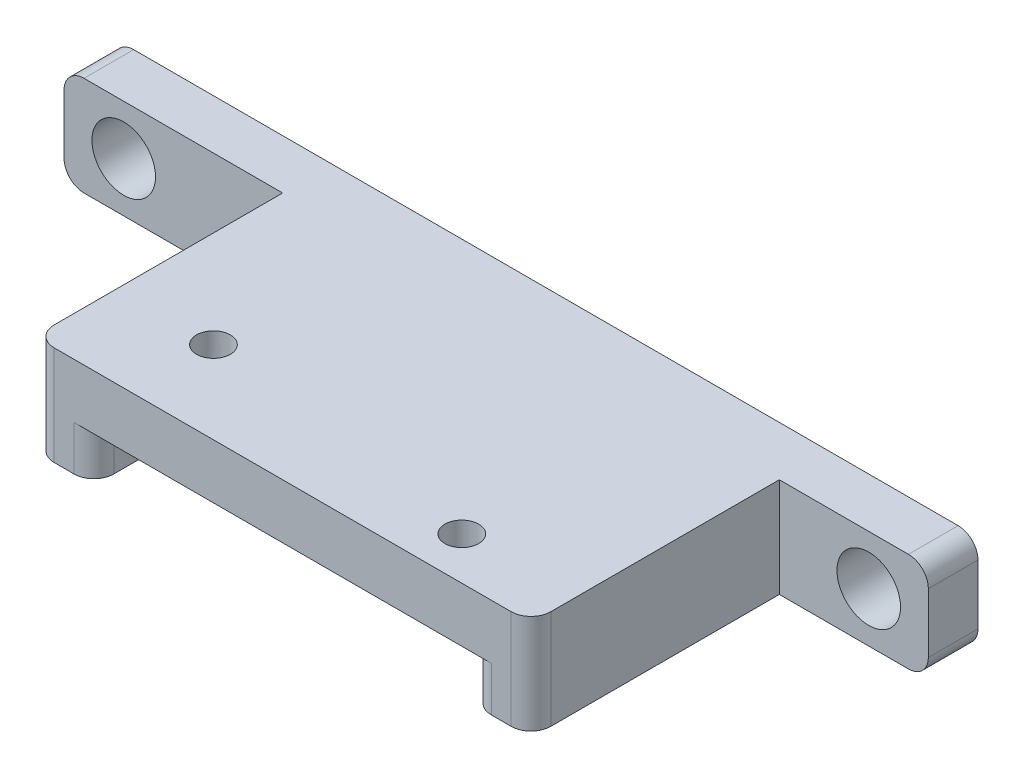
SolidWorks part; units mm, degrees
ref_plane "前视基准面" through (0, 0, 0) normal (0, 0, 1) x (1, 0, 0)
ref_plane "上视基准面" through (0, 0, 0) normal (0, 1, 0) x (1, 0, 0)
ref_plane "右视基准面" through (0, 0, 0) normal (1, 0, 0) x (0, 0, -1)
sketch "草图1" plane through (0, 0, 0) normal (0, 1, 0) x (1, 0, 0)
  line L1 (-40, 15) -> (40, 15)
  line L2 (-40, 15) -> (-40, -15)
  line L3 (-40, -15) -> (40, -15)
  line L4 (40, 15) -> (40, -15)
  line L5 (-40, 15) -> (40, -15) construction
  line L6 (-40, -15) -> (40, 15) construction
  point P0 (0, 0)
  dimension "D1" = 80
  dimension "D2" = 30
extrude "凸台-拉伸1" add sketch "草图1" along normal blind 10
sketch "草图2" plane through (0, 0, 0) normal (0, -1, 0) x (1, 0, 0)
  line L0 (0, 15) -> (0, -19.5246) construction
  line L1 (-40, 15) -> (40, 15) construction
  line L3 (-19, 15) -> (19, 15)
  line L4 (-19, 15) -> (-19, -3)
  line L5 (-19, -3) -> (19, -3)
  line L6 (19, 15) -> (19, -3)
  dimension "D1" = 38
  dimension "D2" = 19
  dimension "D3" = 18
extrude "切除-拉伸1" cut sketch "草图2" against normal blind 4.5
sketch "草图3" plane through (0, 10, 0) normal (0, 1, 0) x (1, 0, 0)
  circle A0 centre (13.7328, -10.7) radius 1.7
  circle A1 centre (-15.2672, -6.7) radius 1.7
  dimension "D1" = 3.4
extrude "切除-拉伸2" cut sketch "草图3" against normal through all
sketch "草图4" plane through (0, 0, 0) normal (0, -1, 0) x (1, 0, 0)
  line L0 (-19, -3) -> (19, -3) construction
  line L1 (-19, 15) -> (-19, -3) construction
  circle A0 centre (-17, -3) radius 2
  circle A1 centre (17, -3) radius 2
  dimension "D1" = 4
extrude "切除-拉伸3" cut sketch "草图4" against normal up to surface (4.5 mm away)
sketch "草图5" plane through (0, 0, 15) normal (0, 0, 1) x (1, 0, 0)
  line L0 (-40, 10) -> (40, 10) construction
  line L1 (40, 0) -> (25, 0)
  line L2 (40, 0) -> (40, 10)
  line L3 (40, 10) -> (25, 10)
  line L4 (25, 0) -> (25, 10)
  line L6 (-40, 0) -> (-25, 0)
  line L7 (-40, 0) -> (-40, 10)
  line L8 (-40, 10) -> (-25, 10)
  line L9 (-25, 0) -> (-25, 10)
  dimension "D1" = 15
  dimension "D2" = 15
extrude "切除-拉伸4" cut sketch "草图5" against normal blind 25
sketch "草图7" plane through (-40, 0, 0) normal (-1, 0, 0) x (0, 0, 1)
  line L4 (-15, 0) -> (-10, 0)
  line L5 (-10, 0) -> (-10, 10)
  line L6 (-10, 10) -> (-15, 10)
  line L7 (-15, 10) -> (-15, 0)
  line L8 (-15, 0) -> (-10, 0)
  line L9 (-10, 0) -> (-10, 10)
  line L10 (-10, 10) -> (-15, 10)
  line L11 (-15, 10) -> (-15, 0)
  dimension "D1" = 0
extrude "凸台-拉伸2" add sketch "草图7" along normal blind 7
sketch "草图6" plane through (0, 0, -10) normal (0, 0, 1) x (1, 0, 0)
  line L0 (40, 5) -> (-46.5373, 5) construction
  line L1 (40, 0) -> (40, 10) construction
  circle A0 centre (34, 5) radius 3.2
  circle A1 centre (-41, 5) radius 3.2
  dimension "D1" = 6
  dimension "D2" = 75
  dimension "D3" = 6.4
  dimension "D4" = 6.4
extrude "切除-拉伸5" cut sketch "草图6" against normal through all
fillet "圆角1" radius 2 8 edges at (-19, 2.25, 15) (19, 2.25, 15) (-25, 5, 15) (25, 5, 15) (-47, 0, -12.5) (-47, 10, -12.5) (40, 0, -12.5) (40, 10, -12.5)
